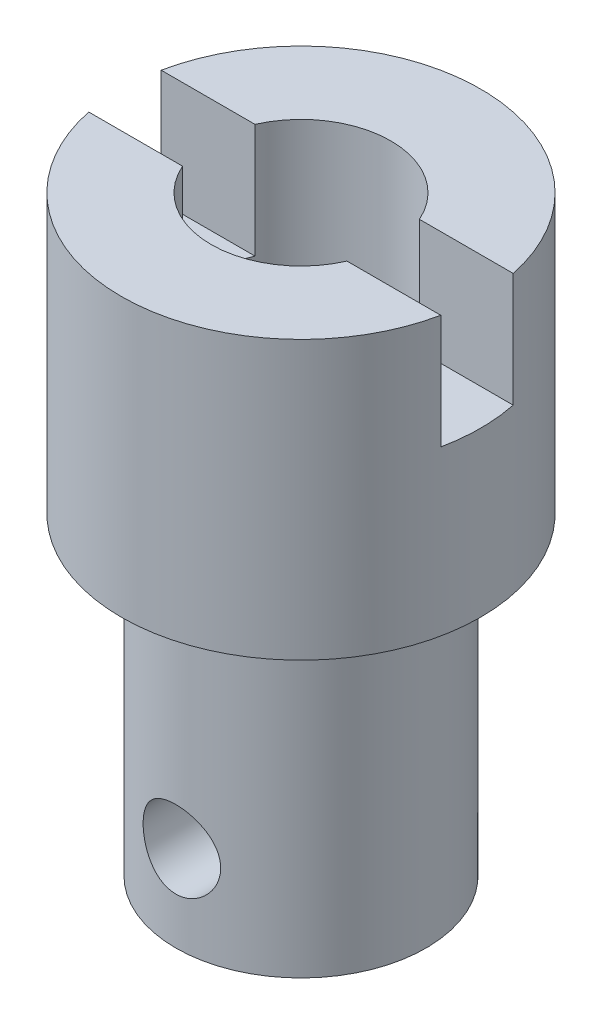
SolidWorks part; units mm, degrees
ref_plane "Front Plane" through (0, 0, 0) normal (0, 0, 1) x (1, 0, 0)
ref_plane "Top Plane" through (0, 0, 0) normal (0, 1, 0) x (1, 0, 0)
ref_plane "Right Plane" through (0, 0, 0) normal (1, 0, 0) x (0, 0, -1)
sketch "Sketch1" plane through (0, 0, 0) normal (0, 0, 1) x (1, 0, 0)
  line L0 (0, 0) -> (0, -39.3299) construction
  line L1 (2.0003, 0) -> (8.001, 0)
  line L2 (8.001, 0) -> (8.001, -12.3698)
  line L3 (8.001, -12.3698) -> (5.5753, -12.3698)
  line L4 (5.5753, -12.3698) -> (5.5753, -26.3398)
  line L5 (5.5753, -26.3398) -> (2.0003, -26.3398)
  line L6 (2.0003, -26.3398) -> (2.0003, 0)
  dimension "D1" = 16.002
  dimension "D2" = 4.0005
  dimension "D3" = 11.1506
  dimension "D4" = 26.3398
  dimension "D5" = 12.3698
revolve "Revolve1" add sketch "Sketch1" angle 360 about L0
sketch "Sketch2" plane through (0, 0, 0) normal (0, 1, 0) x (1, 0, 0)
  circle A0 centre (0, 0) radius 4.0005
  dimension "D1" = 8.001
extrude "Extrude1" cut sketch "Sketch2" against normal blind 8.0518
sketch "Sketch3" plane through (0, 0, 0) normal (0, 1, 0) x (1, 0, 0)
  line L1 (-8.001, 1.6129) -> (8.001, 1.6129)
  line L2 (-8.001, 1.6129) -> (-8.001, -1.6129)
  line L3 (-8.001, -1.6129) -> (8.001, -1.6129)
  line L4 (8.001, 1.6129) -> (8.001, -1.6129)
  circle A0 centre (0, 0) radius 8.001 construction
  point P4 (8.001, 0)
  dimension "D1" = 3.2258
extrude "Extrude2" cut sketch "Sketch3" against normal blind 5.08
sketch "Sketch4" plane through (0, -12.3698, 0) normal (0, -1, 0) x (1, 0, 0)
  circle A0 centre (0, 6.858) radius 0.7938
  dimension "D1" = 1.5875
  dimension "D2" = 6.858
extrude "Extrude3" cut sketch "Sketch4" against normal blind 6.35
ref_plane "Plane1" through (0, 0, 5.5753) normal (0, 0, 1) x (1, 0, 0)
hole_wizard "#8-32 Tapped Hole1" positions "3DSketch1" profile "Sketch5" tap size "#8-32" standard "Ansi Inch"
sketch3d "3DSketch1"
  point P0 (0, -22.5298, 5.5753)
  dimension "D1" = 3.81
sketch "Sketch5" plane through (0, -22.5298, 5.5753) normal (1, 0, 0) x (0, -1, 0)
  line L0 (0, 0) -> (0, 3.575)
  line L1 (0, 3.575) -> (1.7272, 3.575)
  line L2 (1.7272, 3.575) -> (1.7272, 0)
  line L5 (1.7272, 0) -> (0, 0)
  line L11 (0, -6.35) -> (0, 107.95) construction
  dimension "Thru Tap Drill Dia." = 3.4544
  dimension "Thru Tap Drill Depth" = 3.575
